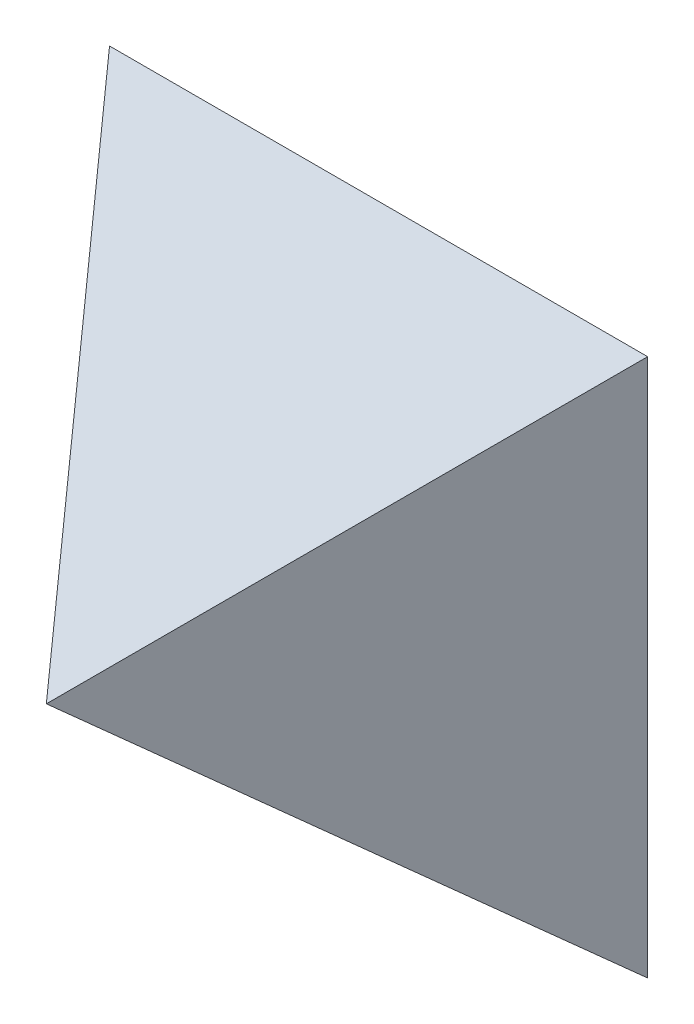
SolidWorks part; units mm, degrees
ref_plane "Plan de face" through (0, 0, 0) normal (0, 0, 1) x (1, 0, 0)
ref_plane "Plan de dessus" through (0, 0, 0) normal (0, 1, 0) x (1, 0, 0)
ref_plane "Plan de droite" through (0, 0, 0) normal (1, 0, 0) x (0, 0, -1)
sketch "Esquisse1" plane through (0, 0, 0) normal (0, 0, 1) x (1, 0, 0)
  line L1 (-14.8327, 16.1631) -> (34985.1673, 16.1631)
  line L2 (-14.8327, 16.1631) -> (-14.8327, -34983.8369)
  line L3 (-14.8327, -34983.8369) -> (34985.1673, -34983.8369)
  line L4 (34985.1673, 16.1631) -> (34985.1673, -34983.8369)
  dimension "D1" = 35000
  dimension "D2" = 35000
extrude "Boss.-Extru.1" add sketch "Esquisse1" along normal blind 21600
chamfer "Chanfrein2" distance 21600 angle 39 4 edges at (-14.8327, -17483.8369, 21600) (17485.1673, 16.1631, 21600) (34985.1673, -17483.8369, 21600) (17485.1673, -34983.8369, 21600)
